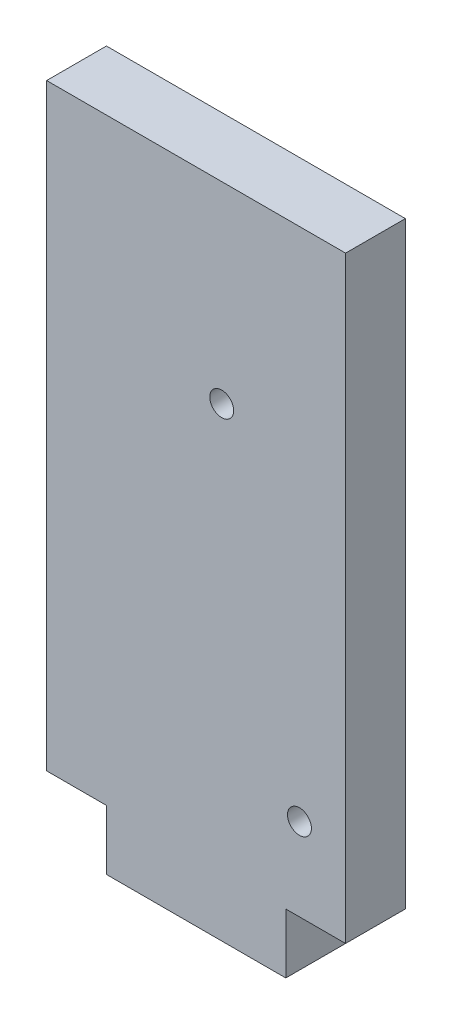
SolidWorks part; units mm, degrees
ref_plane "Alzado" through (0, 0, 0) normal (0, 0, 1) x (1, 0, 0)
ref_plane "Planta" through (0, 0, 0) normal (0, 1, 0) x (1, 0, 0)
ref_plane "Vista lateral" through (0, 0, 0) normal (1, 0, 0) x (0, 0, -1)
sketch "Sketch1" plane through (0, 0, 0) normal (0, 1, 0) x (1, 0, 0)
  line L1 (-7.5, -2.5) -> (7.5, -2.5)
  line L2 (-7.5, -2.5) -> (-7.5, 2.5)
  line L3 (-7.5, 2.5) -> (7.5, 2.5)
  line L4 (7.5, -2.5) -> (7.5, 2.5)
  line L5 (-7.5, -2.5) -> (7.5, 2.5) construction
  line L6 (-7.5, 2.5) -> (7.5, -2.5) construction
  point P0 (0, 0)
  dimension "D1" = 15
  dimension "D2" = 5
extrude "Boss-Extrude1" add sketch "Sketch1" along normal blind 5
sketch "Sketch2" plane through (0, 5, 0) normal (0, 1, 0) x (1, 0, 0)
  line L1 (-12.5, -2.5) -> (12.5, -2.5)
  line L2 (-12.5, -2.5) -> (-12.5, 2.5)
  line L3 (-12.5, 2.5) -> (12.5, 2.5)
  line L4 (12.5, -2.5) -> (12.5, 2.5)
  line L5 (-12.5, -2.5) -> (12.5, 2.5) construction
  line L6 (-12.5, 2.5) -> (12.5, -2.5) construction
  point P0 (0, 0)
  dimension "D1" = 5
  dimension "D2" = 25
extrude "Boss-Extrude2" add sketch "Sketch2" along normal blind 50
sketch "Sketch3" plane through (0, 0, 2.5) normal (0, 0, 1) x (1, 0, 0)
  line L0 (12.5, 5) -> (12.5, 11.9035) construction
  line L1 (12.5, 55) -> (12.5, 5) construction
  line L2 (12.5, 11.9035) -> (8.6429, 11.9035) construction
  line L3 (8.6429, 11.9035) -> (8.6429, 38.9035) construction
  line L4 (8.6429, 38.9035) -> (2.1429, 38.9035) construction
  circle A0 centre (8.6429, 11.9035) radius 1
  circle A1 centre (2.1429, 38.9035) radius 1
  dimension "D3" = 2
  dimension "D1" = 6.5
  dimension "D2" = 27
extrude "Cut-Extrude1" cut sketch "Sketch3" against normal blind 50
